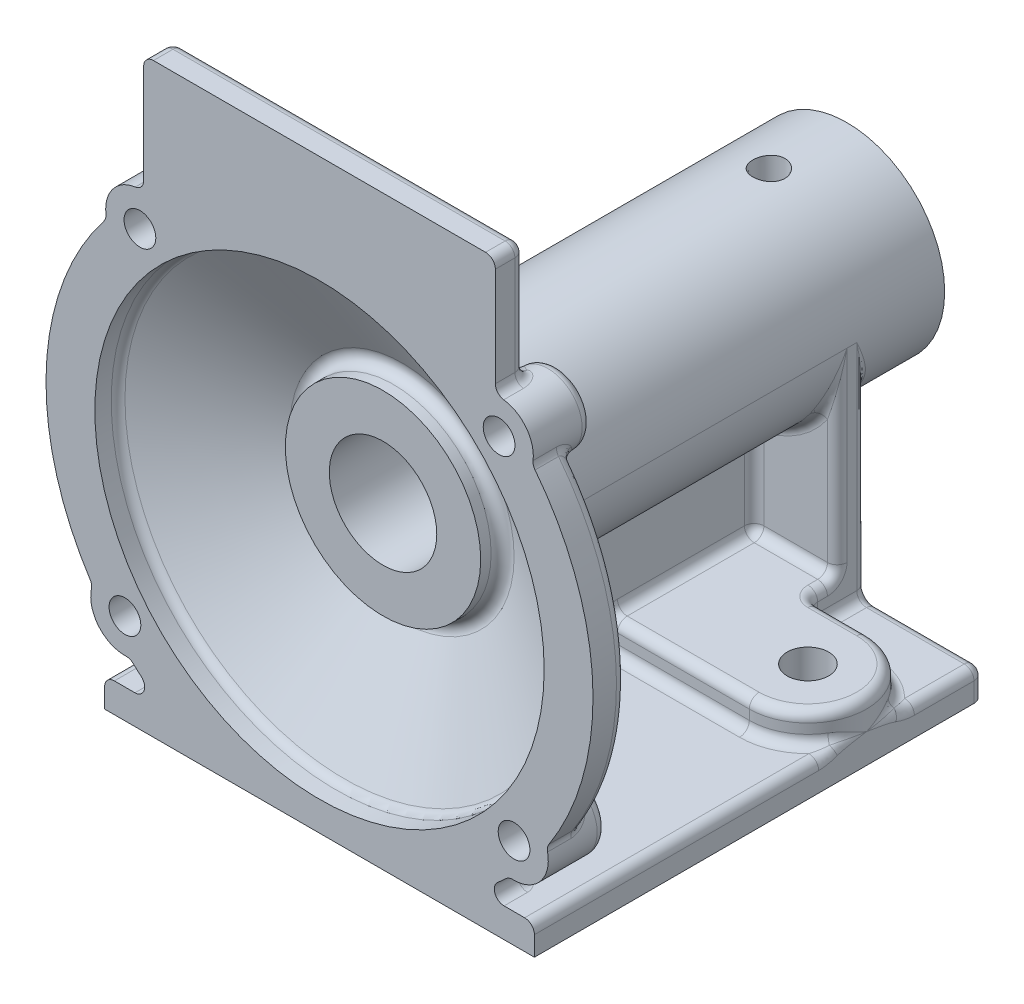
SolidWorks part; units mm, degrees
ref_plane "Front" through (0, 0, 0) normal (0, 0, 1) x (1, 0, 0)
ref_plane "Top" through (0, 0, 0) normal (0, 1, 0) x (1, 0, 0)
ref_plane "Right" through (0, 0, 0) normal (1, 0, 0) x (0, 0, -1)
sketch "Sketch1" plane through (0, 0, 0) normal (1, 0, 0) x (0, 0, -1)
  line L0 (0, 0) -> (89.8884, 0) construction
  line L1 (0, -73.025) -> (0, -88.9)
  line L2 (0, -88.9) -> (9.525, -88.9)
  line L3 (9.525, -88.9) -> (40.1411, -31.75)
  line L4 (40.1411, -31.75) -> (171.45, -31.75)
  line L5 (171.45, -31.75) -> (171.45, -17.4625)
  line L6 (171.45, -17.4625) -> (120.65, -17.4625)
  line L7 (120.65, -17.4625) -> (120.65, -20.6375)
  line L8 (120.65, -20.6375) -> (69.85, -20.6375)
  line L9 (69.85, -20.6375) -> (69.85, -17.4625)
  line L10 (69.85, -17.4625) -> (20.6502, -17.4625)
  line L11 (20.6502, -17.4625) -> (20.6502, -31.75)
  line L12 (20.6502, -31.75) -> (29.3354, -31.75)
  line L13 (29.3354, -31.75) -> (7.2238, -73.025)
  line L14 (7.2238, -73.025) -> (0, -73.025)
  point P5 (57.15, 0)
  dimension "D1" = 34.925
  dimension "D2" = 41.275
  dimension "D3" = 50.8
  dimension "D4" = 50.8
  dimension "D5" = 63.5
  dimension "D6" = 146.05
  dimension "D7" = 177.8
  dimension "D8" = 9.525
  dimension "D9" = 9.525
  dimension "D10" = 20.6502
  dimension "D11" = 171.45
  dimension "D12" = 57.15
revolve "Revolve1" add sketch "Sketch1" angle 360 about L0
sketch "Sketch2" plane through (0, 0, 0) normal (0, 0, 1) x (1, 0, 0)
  line L0 (0, 0) -> (0, 144.1236) construction
  line L1 (-57.15, 68.0962) -> (-26.3735, 68.0962)
  line L2 (-57.15, 68.0962) -> (-57.15, 107.95)
  line L3 (-57.15, 107.95) -> (57.15, 107.95)
  line L4 (57.15, 68.0962) -> (57.15, 107.95)
  line L5 (26.3735, 68.0962) -> (57.15, 68.0962)
  circle A0 centre (0, 0) radius 88.9 construction
  circle A1 centre (0, 0) radius 73.025 construction
  arc A2 (26.3735, 68.0962) -> (-26.3735, 68.0962) centre (0, 0) ccw
  dimension "D1" = 114.3
  dimension "D2" = 107.95
extrude "Extrude1" add sketch "Sketch2" against normal blind 9.525
sketch "Sketch3" plane through (0, 0, 0) normal (0, 0, 1) x (1, 0, 0)
  line L0 (0, 0) -> (105.8426, 0) construction
  line L1 (0, 0) -> (73.9921, 73.9921) construction
  line L2 (49.9927, 65.6904) -> (43.7106, 58.4982)
  line L3 (65.6904, 49.9927) -> (58.4982, 43.7106)
  circle A0 centre (0, 0) radius 82.55 construction
  arc A1 (49.9927, 65.6904) -> (65.6904, 49.9927) centre (58.3717, 58.3717) cw
  circle A2 centre (0, 0) radius 73.025 construction
  circle A3 centre (0, 0) radius 73.025 construction
  arc A4 (58.4982, 43.7106) -> (43.7106, 58.4982) centre (0, 0) ccw
  dimension "D2" = 165.1
  dimension "D3" = 11.1252
  dimension "D1" = 45
extrude "Extrude2" add sketch "Sketch3" against normal blind 19.05
sketch "Sketch4" plane through (0, 0, -19.05) normal (0, 0, -1) x (-1, 0, 0)
  circle A0 centre (-58.3717, 58.3717) radius 5.1562
  dimension "D1" = 10.3124
extrude "Extrude3" cut sketch "Sketch4" against normal through all
pattern_circular "CirPattern1" count 2 every 85 about axis through (0, 0, 0) along (0, 0, 1) of "Extrude2", "Extrude3"
mirror "Mirror1" about plane through (0, 0, 0) normal (1, 0, 0) of "CirPattern1", "Extrude2", "Extrude3"
other "DeleteFace1"
ref_plane "Plane1" through (0, -82.55, 0) normal (0, 1, 0) x (-1, 0, 0)
other "SurfaceCut1"
sketch "Sketch5" plane through (0, -82.55, 0) normal (0, 1, 0) x (-1, 0, 0)
  line L0 (0, -146.05) -> (0, 0) construction
  line L1 (-69.85, 0) -> (69.85, 0)
  line L2 (-69.85, 0) -> (-69.85, -146.05)
  line L3 (-69.85, -146.05) -> (69.85, -146.05)
  line L4 (69.85, 0) -> (69.85, -146.05)
  dimension "D1" = 139.7
  dimension "D2" = 146.05
extrude "Extrude4" add sketch "Sketch5" along normal blind 9.525
sketch "Sketch8" plane through (0, 0, -146.05) normal (0, 0, -1) x (-1, 0, 0)
  line L0 (0, -73.025) -> (0, -31.75)
  line L1 (-69.85, -73.025) -> (69.85, -73.025) construction
  circle A0 centre (0, 0) radius 31.75 construction
rib "Rib2" sketch "Sketch8" sketch "Sketch8" thickness 9.525 extrusion direction normal to sketch draft on no parameters "D1"=9.525
sketch "Sketch9" plane through (0, 0, -146.05) normal (0, 0, -1) x (-1, 0, 0)
  line L0 (-31.75, 0) -> (-31.75, -73.025)
  line L4 (-4.7625, -73.025) -> (-50.7007, -73.025) construction
  line L6 (31.75, 0) -> (31.75, -73.025)
  line L7 (50.7007, -73.025) -> (4.7625, -73.025) construction
  line L8 (-31.75, -73.025) -> (31.75, -73.025)
  arc A4 (4.7625, -31.3908) -> (-4.7625, -31.3908) centre (0, 0) ccw construction
  circle A5 centre (0, 0) radius 31.75 construction
  arc A6 (-31.75, 0) -> (31.75, 0) centre (0, 0) ccw
extrude "Extrude5" add sketch "Sketch9" against normal blind 9.525
sketch "Sketch10" plane through (0, 0, 0) normal (1, 0, 0) x (0, 0, -1)
  line L0 (0, -49.5673) -> (0, -64.1873) construction
  line L1 (0, -82.55) -> (146.05, -82.55) construction
  circle A0 centre (63.5, -53.975) radius 12.7
  dimension "D1" = 25.4
  dimension "D2" = 63.5
  dimension "D3" = 28.575
extrude "Extrude6" cut sketch "Sketch10" against normal through all and the other way through all
sketch "Sketch11" plane through (0, -73.025, 0) normal (0, 1, 0) x (1, 0, 0)
  line L0 (31.75, 146.05) -> (4.7625, 146.05)
  line L1 (31.75, 146.05) -> (-31.75, 146.05) construction
  line L2 (4.7625, 146.05) -> (4.7625, 88.9)
  line L3 (4.7625, 136.525) -> (4.7625, 40.1411) construction
  line L4 (4.7625, 88.9) -> (50.8, 88.9)
  line L5 (50.8, 127) -> (31.75, 127)
  line L6 (31.75, 40.1411) -> (31.75, 136.525) construction
  line L7 (31.75, 127) -> (31.75, 146.05)
  line L8 (69.85, 0) -> (69.85, 146.05) construction
  line L10 (57.15, 0) -> (-57.15, 0) construction
  arc A0 (50.8, 88.9) -> (50.8, 127) centre (50.8, 107.95) ccw
  dimension "D1" = 50.8
  dimension "D2" = 107.95
extrude "Extrude7" add sketch "Sketch11" along normal blind 9.525
sketch "Sketch12" plane through (0, -63.5, 0) normal (0, 1, 0) x (1, 0, 0)
  circle A0 centre (50.8, 107.95) radius 6.7437
  dimension "D1" = 13.4874
extrude "Extrude8" cut sketch "Sketch12" against normal through all
mirror "Mirror2" about plane through (0, 0, 0) normal (1, 0, 0) of "Extrude8", "Extrude7"
ref_plane "Plane2" through (0, 31.75, -105.7955) normal (0, 1, 0) x (-1, 0, 0)
sketch "Sketch13" plane through (0, 31.75, -105.7955) normal (0, 1, 0) x (-1, 0, 0)
  line L0 (0, 44.0417) -> (0, 112.0674) construction
  line L1 (-11.1252, 65.6545) -> (11.1252, 65.6545)
  line L2 (-31.75, 65.6545) -> (31.75, 65.6545) construction
  line L3 (11.1252, 65.6545) -> (11.1252, 61.3455)
  line L4 (-11.1252, 61.3455) -> (-11.1252, 65.6545)
  line L5 (-20.6375, 35.9455) -> (20.6375, 35.9455) construction
  arc A0 (11.1252, 61.3455) -> (-11.1252, 61.3455) centre (0, 61.3455) cw
  dimension "D1" = 11.1252
  dimension "D2" = 25.4
extrude "Extrude9" add sketch "Sketch13" along normal blind 6.35 and the other way up to next
other "DeleteFace2"
hole_wizard "1/8 NPT Tapped Hole1" positions "3DSketch1" profile "Sketch14" size "1/8" standard "Ansi Inch"
sketch3d "3DSketch1"
  arc A0 (11.1252, 38.1, -44.45) -> (-11.1252, 38.1, -44.45) centre (0, 38.1, -44.45) ccw construction
  point P0 (0, 38.1, -44.45)
  point P2 (0, 31.75, -146.05)
  point P9 (0, 49.2252, -44.45)
  dimension "D1" = 25.4
sketch "Sketch14" plane through (0, 38.1, -44.45) normal (1, 0, 0) x (0, 0, 1)
  line L0 (0, 0) -> (0, 20.6375)
  line L1 (0, 20.6375) -> (4.2164, 20.6375)
  line L2 (-4.9362, 9.525) -> (-5.2214, 0) construction
  line L3 (4.2164, 20.6375) -> (4.2164, 9.525)
  line L4 (4.2164, 9.525) -> (4.9362, 9.525)
  line L5 (4.9362, 9.525) -> (5.2214, 0)
  line L7 (5.2214, 0) -> (0, 0)
  line L8 (0, -6.35) -> (0, 107.95) construction
  line L11 (-4.2164, 9.525) -> (-4.9362, 9.525) construction
  dimension "Thru Tap Drill Dia." = 8.4328
  dimension "Thru Tap Drill Depth" = 20.6375
  dimension "Thread Dia." = 10.4428
  dimension "Thread Angle" = 3.43
  dimension "Thread Depth" = 9.525
fillet "Fillet1" radius 3.175 14 edges at (-31.75, -31.75, -136.525) (31.75, -31.75, -136.525) (-31.75, -63.5, -131.7625) (31.75, -63.5, -131.7625) (-27.7812, -63.5, -88.9) (-41.275, -63.5, -127) (27.7812, -63.5, -88.9) (41.275, -63.5, -127) (-18.2562, -63.5, -136.525) (-31.75, -68.2625, -127) (-69.85, -63.5, -107.95) (18.2563, -63.5, -136.525) (31.75, -68.2625, -127) (69.85, -63.5, -107.95)
fillet "Fillet2" radius 3.175 24 edges at (-31.75, -73.025, -138.1125) (-32.6799, -73.025, -127.9299) (-42.8625, -73.025, -127) (-64.2704, -73.025, -121.4204) (-64.2704, -73.025, -94.4796) (-4.7625, -45.8579, -136.525) (-4.7625, -62.5701, -135.5951) (-4.7625, -63.5, -112.7125) (-4.7625, -64.4299, -89.8299) (4.7625, -45.8579, -136.525) (4.7625, -62.5701, -135.5951) (4.7625, -63.5, -112.7125) (4.7625, -64.4299, -89.8299) (31.75, -73.025, -138.1125) (32.6799, -73.025, -127.9299) (42.8625, -73.025, -127) (64.2704, -73.025, -121.4204) (64.2704, -73.025, -94.4796) (-27.7812, -73.025, -88.9) (-4.7625, -69.85, -88.9) (-4.7625, -73.025, -53.4232) (4.7625, -73.025, -53.4232) (4.7625, -69.85, -88.9) (27.7812, -73.025, -88.9)
fillet "Fillet3" radius 3.175 28 edges at (-50.7007, -73.025, -4.7625) (50.7007, -73.025, -4.7625) (31.75, -34.925, -146.05) (32.6799, -72.0951, -146.05) (69.85, -73.025, -48.2512) (69.85, -73.025, -102.2262) (69.85, -73.025, -113.6738) (6.0975, -72.4375, -18.207) (-5.6525, -72.0545, -18.4308) (-31.75, -34.925, -146.05) (-32.6799, -72.0951, -146.05) (-69.85, -73.025, -48.2512) (-69.85, -73.025, -102.2262) (-69.85, -73.025, -113.6738) (69.85, -77.7875, -146.05) (52.3875, -73.025, -146.05) (69.85, -73.025, -132.7238) (56.3432, -68.7652, -9.525) (-56.3432, -68.7652, -9.525) (-69.85, -77.7875, -146.05) (-52.3875, -73.025, -146.05) (-69.85, -73.025, -132.7238) (-4.7625, -41.275, -63.5) (4.7625, -41.275, -63.5)
fillet "Fillet4" radius 3.175 21 edges at (11.1252, 38.1, -40.1685) (-11.1252, 38.1, -40.1685) (-11.1252, 29.7371, -42.2955) (11.1252, 29.7371, -42.2955) (-30.6752, -8.191, -137.3189) (-31.6957, -1.8554, -40.1411) (-5.5714, -31.2574, -41.0895) (-4.7625, -31.3908, -88.3781) (-5.9268, -31.1919, -135.8072) (31.6957, -1.8554, -40.1411) (5.9455, -31.1884, -40.7249) (4.7625, -31.3908, -88.3781) (5.4424, -31.2801, -135.3134) (30.6752, -8.191, -137.3189) (-30.6752, -8.191, -145.2561) (30.6752, -8.191, -145.2561) (0, 38.1, -55.5752) (0.9693, 31.7352, -55.5329) (-20.1175, -24.5632, -136.525) (20.1175, -24.5632, -136.525) (0, -31.75, -146.05)
fillet "Fillet5" radius 3.175 15 edges at (51.3964, -57.1126, -19.05) (65.1698, -40.6981, -19.05) (-51.3964, -57.1126, -19.05) (-65.1698, -40.6981, -19.05) (-61.3748, 46.2232, -19.05) (-46.2232, 61.3748, -19.05) (61.3748, 46.2232, -19.05) (46.2232, 61.3748, -19.05) (71.7594, -60.2133, -19.05) (-71.7594, -60.2133, -19.05) (-66.2384, 66.2384, -19.05) (66.2384, 66.2384, -19.05) (-88.8154, 3.8778, -9.525) (0, 88.9, -9.525) (88.8154, 3.8778, -9.525)
fillet "Fillet6" radius 3.175 48 edges at (-57.15, 69.4296, -4.7625) (57.15, 69.4296, -4.7625) (-61.6293, -64.0705, -3.812) (-61.4023, -64.035, -8.6861) (-57.773, -62.7531, -11.4549) (-49.0287, -52.2246, -18.7754) (-73.799, -49.5673, -3.812) (-73.5874, -48.983, -9.3353) (-60.473, -39.116, -18.5672) (-69.1981, 55.8107, -3.812) (-69.1429, 55.5876, -8.6861) (-67.5496, 52.0839, -11.4549) (-56.299, 44.2904, -18.7754) (-56.9935, 69.4112, -9.525) (-55.2807, 69.0589, -9.7761) (-53.2439, 68.2447, -10.7798) (-44.2377, 56.8337, -18.5672) (69.1981, 55.8107, -3.812) (69.0382, 55.2102, -9.3353) (67.5496, 52.0839, -11.4549) (56.8337, 44.2377, -18.5672) (56.9935, 69.4112, -9.525) (56.5106, 69.3401, -9.5345) (53.2439, 68.2447, -10.7798) (44.2904, 56.299, -18.7754) (61.6293, -64.0705, -3.812) (61.0172, -63.9636, -9.3353) (57.773, -62.7531, -11.4549) (49.0228, -52.7619, -18.5672) (73.799, -49.5673, -3.812) (73.7246, -49.3499, -8.6861) (59.9449, -39.2151, -18.7754) (-57.15, 88.6898, -9.525) (57.15, 88.6898, -9.525) (-54.4811, -45.7151, -19.05) (-50.2894, 50.2894, -19.05) (50.2894, 50.2894, -19.05) (54.4811, -45.7151, -19.05)
fillet "Fillet7" radius 3.175 5 edges at (57.15, 107.95, -3.175) (56.2201, 107.95, -8.5951) (-57.15, 107.95, -3.175) (-56.2201, 107.95, -8.5951) (0, 107.95, -9.525)
fillet "Fillet8" radius 3.175 4 edges at (73.025, 0, -7.2238) (31.75, 0, -29.3354) (20.6375, 0, -120.65) (20.6375, 0, -69.85)
